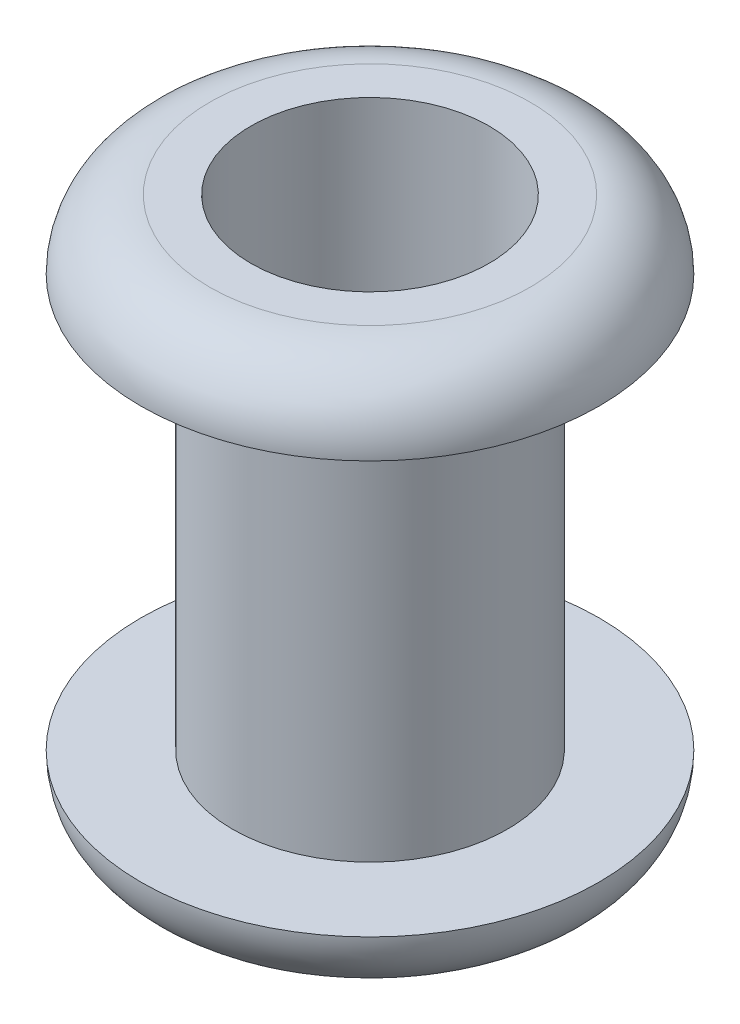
SolidWorks part; units mm, degrees
ref_plane "Front" through (0, 0, 0) normal (0, 0, 1) x (1, 0, 0)
ref_plane "Top" through (0, 0, 0) normal (0, 1, 0) x (1, 0, 0)
ref_plane "Right" through (0, 0, 0) normal (1, 0, 0) x (0, 0, -1)
sketch "Sketch1" plane through (0, 0, 0) normal (0, 1, 0) x (1, 0, 0)
  circle A0 centre (0, 0) radius 1.5
  circle A1 centre (0, 0) radius 1.2
  dimension "D1" = 3
  dimension "D2" = 0.3
extrude "Extrude1" add sketch "Sketch1" along normal blind 4.5
sketch "Sketch2" plane through (0, 4.5, 0) normal (0, 1, 0) x (-1, 0, 0)
  circle A0 centre (0, 0) radius 2.5
extrude "Extrude2" add sketch "Sketch2" along normal blind 0.75
sketch "Sketch3" plane through (0, 0, 0) normal (0, -1, 0) x (1, 0, 0)
  circle A0 centre (0, 0) radius 2.5
extrude "Extrude3" add sketch "Sketch3" along normal blind 0.75
sketch "Sketch4" plane through (0, -0.75, 0) normal (0, -1, 0) x (1, 0, 0)
  circle A0 centre (0, 0) radius 1.3
extrude "Cut-Extrude1" cut sketch "Sketch4" against normal through all
fillet "Fillet1" radius 0.75 2 edges at (0, -0.75, -2.5) (0, 5.25, 2.5)
